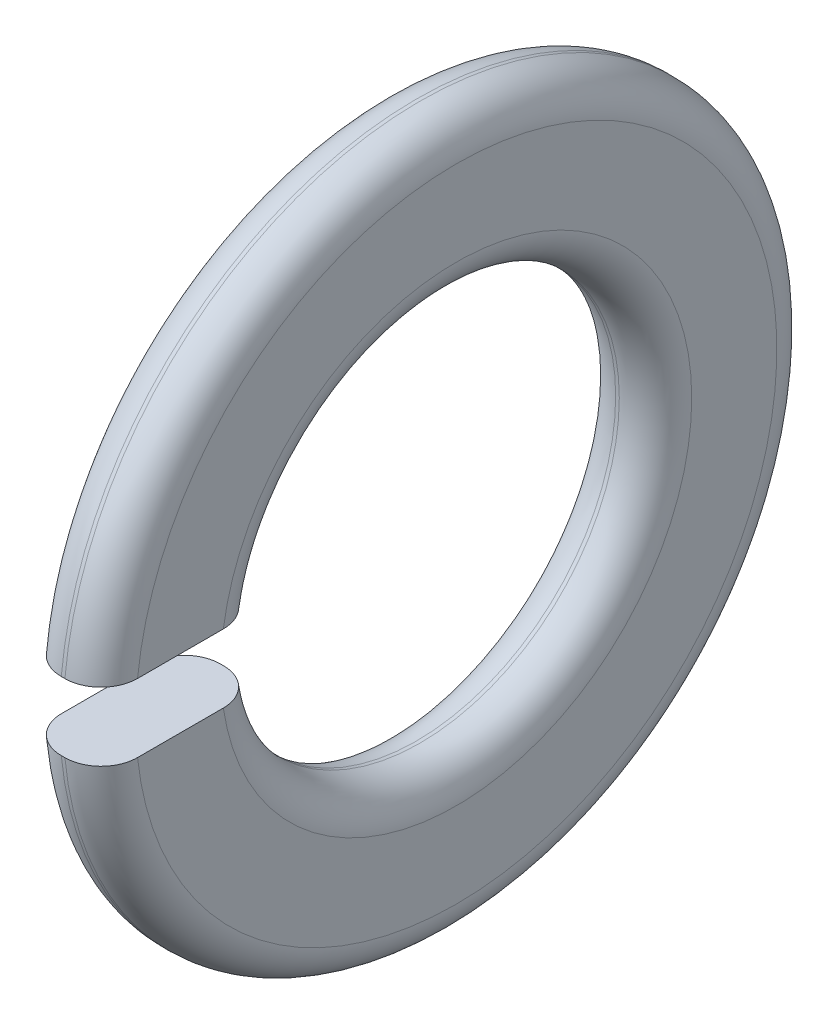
SolidWorks part; units mm, degrees
ref_plane "Plane1" through (0, 0, 0) normal (0, 0, 1) x (1, 0, 0)
ref_plane "Plane2" through (0, 0, 0) normal (0, 1, 0) x (1, 0, 0)
ref_plane "Plane3" through (0, 0, 0) normal (1, 0, 0) x (0, 0, -1)
sketch "Sketch1" plane through (0, 0, 0) normal (0, 0, 1) x (1, 0, 0)
  line L0 (-34.925, 0) -> (9.525, 0) construction
  line L1 (0, 6.5) -> (0, 8.85)
  line L2 (-1, 9.85) -> (-1.1, 9.85)
  line L3 (-2.1, 8.85) -> (-2.1, 6.5)
  line L4 (-1.1, 5.5) -> (-1, 5.5)
  arc A0 (-1.1, 5.5) -> (-2.1, 6.5) centre (-1.1, 6.5) cw
  arc A1 (0, 6.5) -> (-1, 5.5) centre (-1, 6.5) cw
  arc A2 (-1.1, 9.85) -> (-2.1, 8.85) centre (-1.1, 8.85) ccw
  arc A3 (0, 8.85) -> (-1, 9.85) centre (-1, 8.85) ccw
  point P8 (-2.1, 5.5)
  point P14 (-2.1, 9.85)
  point P17 (0, 9.85)
revolve "Base-Revolve" add sketch "Sketch1" angle 360 about L0
sketch "Sketch2" plane through (0, 0, 0) normal (-1, 0, 0) x (0, -1, 0)
  line L0 (-0.945, 0) -> (0.945, 0)
  line L1 (0, 0) -> (0, 12.7) construction
  line L2 (0.945, 0) -> (0.945, 10.047)
  line L3 (0.945, 10.047) -> (-0.945, 10.047)
  line L4 (-0.945, 10.047) -> (-0.945, 0)
extrude "Gap" cut sketch "Sketch2" along normal through all
equation "\"D1@Sketch1\" = \"Fillet_rad@Sketch1\""
equation "\"D1@Sketch2\" = \"Thickness@Sketch1\" * 0.9"
equation "\"D2@Sketch2\" = \"Outside_dia@Sketch1\" * 0.51"
equation "\"D2@Sketch1\" = \"Fillet_rad@Sketch1\""
